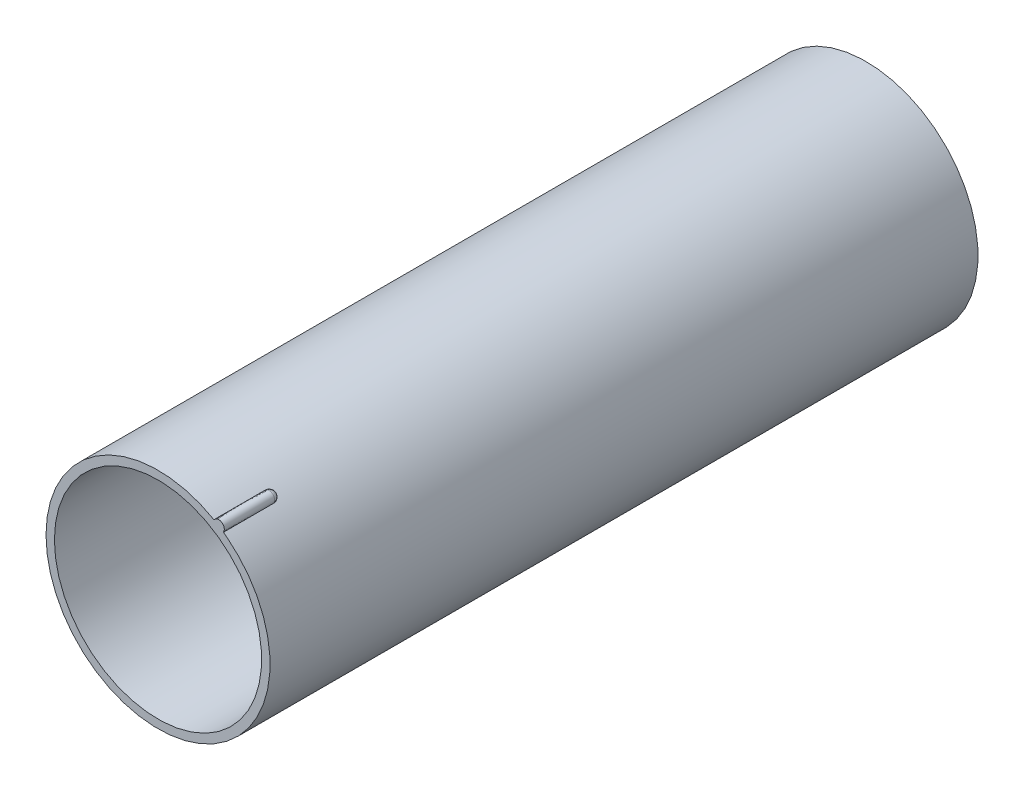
SolidWorks part; units mm, degrees
ref_plane "Спереди" through (0, 0, 0) normal (0, 0, 1) x (1, 0, 0)
ref_plane "Сверху" through (0, 0, 0) normal (0, 1, 0) x (1, 0, 0)
ref_plane "Справа" through (0, 0, 0) normal (1, 0, 0) x (0, 0, -1)
sketch "Эскиз2" plane through (0, 0, 0) normal (0, 0, 1) x (1, 0, 0)
  circle A0 centre (0, 0) radius 20
  circle A1 centre (0, 0) radius 18.5
  dimension "D1" = 40
  dimension "D2" = 37
extrude "Бобышка-Вытянуть1" add sketch "Эскиз2" along normal blind 126.4
sketch "Эскиз5" plane through (0, 0, 0) normal (0, 0, -1) x (-1, 0, 0)
  line L0 (0, 0) -> (0, 18.5) construction
  line L1 (0, 0) -> (2.9901, 18.2568) construction
  line L2 (0, 18.5) -> (0, 9.2195)
  line L3 (2.9901, 18.2568) -> (1.4901, 9.0983)
  circle A0 centre (0, 0) radius 18.5 construction
  arc A1 (0, 18.5) -> (2.9901, 18.2568) centre (0, 0) cw
  arc A2 (1.4901, 9.0983) -> (3.3687, 3.6948) centre (7.4112, 8.1286) ccw
  circle A3 centre (0, 0) radius 3
  arc A4 (-2.7273, 4.1907) -> (3.3687, 3.6948) centre (0, 0) ccw
  arc A5 (0, 9.2195) -> (-2.7273, 4.1907) centre (-6, 9.2195) cw
  point P16 (0, 5)
  dimension "D2" = 5
  dimension "D3" = 6
  dimension "D4" = 6
  dimension "D1" = 3
extrude "Бобышка-Вытянуть3" add sketch "Эскиз5" against normal through all
sketch "Sketch1" plane through (0, 0, 0) normal (0, 0, -1) x (-1, 0, 0)
  circle A0 centre (0, 0) radius 18.5
  arc A1 (0, 18.5) -> (2.9901, 18.2568) centre (0, 0) ccw construction
extrude "Cut-Extrude1" cut sketch "Sketch1" against normal blind 59
sketch "Sketch2" plane through (0, 0, 126.4) normal (0, 0, 1) x (1, 0, 0)
  circle A0 centre (0, 0) radius 18.5
  arc A1 (-2.9901, 18.2568) -> (0, 18.5) centre (0, 0) ccw construction
extrude "Cut-Extrude2" cut sketch "Sketch2" against normal blind 59
sketch "Sketch4" plane through (0, 0, 126.4) normal (0, 0, 1) x (1, 0, 0)
  line L0 (0, 0) -> (0, 18.5) construction
  line L1 (0, 18.5) -> (9.25, 16.0215) construction
  line L2 (9.25, 16.0215) -> (0, 0) construction
  line L3 (9.25, 16.0215) -> (10, 17.3205) construction
  line L4 (10, 17.3205) -> (11.6799, 16.2352)
  circle A0 centre (0, 0) radius 18.5 construction
  circle A1 centre (0, 0) radius 20 construction
  arc A2 (10, 17.3205) -> (11.6799, 16.2352) centre (10.8399, 16.7778) cw
  dimension "D2" = 1
  dimension "D1" = 30
  dimension "D3" = 2
extrude "Boss-Extrude2" add sketch "Sketch4" against normal blind 10
fillet "Fillet1" radius 1 1 edges at (11.3826, 17.6178, 116.4)
